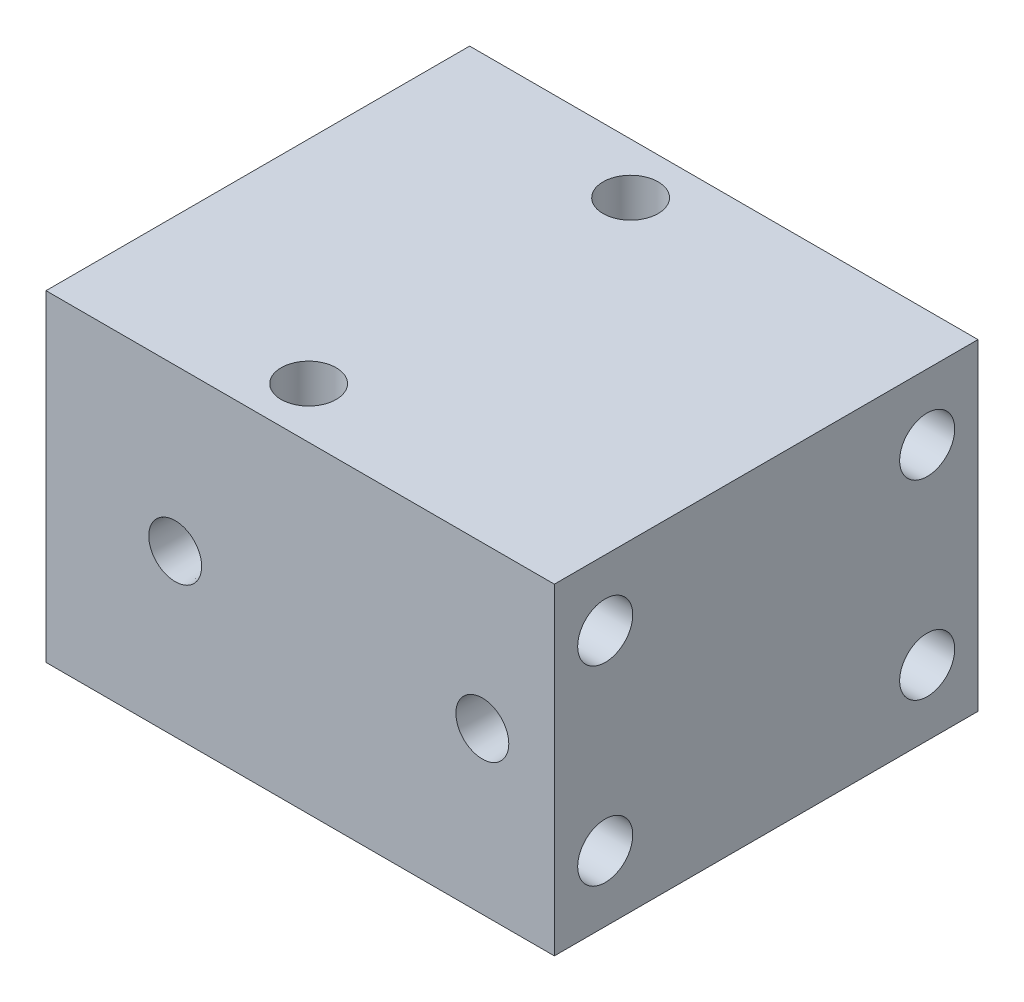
SolidWorks part; units mm, degrees
ref_plane "Front Plane" through (0, 0, 0) normal (0, 0, 1) x (1, 0, 0)
ref_plane "Top Plane" through (0, 0, 0) normal (0, 1, 0) x (1, 0, 0)
ref_plane "Right Plane" through (0, 0, 0) normal (1, 0, 0) x (0, 0, -1)
sketch "Sketch1" plane through (0, 0, 0) normal (0, 1, 0) x (1, 0, 0)
  line L0 (-10, 38) -> (-10, -38) construction
  line L1 (-60, 50) -> (60, 50)
  line L2 (-60, 50) -> (-60, -50)
  line L3 (-60, -50) -> (60, -50)
  line L4 (60, 50) -> (60, -50)
  line L5 (-60, 0) -> (-10, 0) construction
  circle A0 centre (-10, 38) radius 6.5
  circle A1 centre (-10, -38) radius 6.5
  dimension "D5" = 13
  dimension "D6" = 13
  dimension "D8" = 50
  dimension "D1" = 100
  dimension "D2" = 50
  dimension "D3" = 120
  dimension "D4" = 60
  dimension "D7" = 76
extrude "H1" add sketch "Sketch1" along normal blind 76
sketch "Sketch2" plane through (-60, 0, 0) normal (-1, 0, 0) x (0, 0, 1)
  line L0 (0, 0) -> (0, 38) construction
  line L1 (50, 38) -> (0, 38) construction
  line L2 (50, 76) -> (50, 0) construction
  circle A0 centre (0, 38) radius 0.5
  dimension "D1" = 1
extrude "CENTER HOLE" cut sketch "Sketch2" against normal blind 60
hole_wizard "1/4 NPT Tapped Hole1" positions "Sketch4" profile "Sketch3" size "1/4" standard "Ansi Inch"
sketch "Sketch4" plane through (0, 0, 50) normal (0, 0, 1) x (1, 0, 0)
  line L0 (-60, 38) -> (60, 38) construction
  line L1 (-60, 76) -> (-60, 0) construction
  line L2 (60, 76) -> (60, 0) construction
  point P0 (43, 38)
  point P1 (-29.5, 38)
  dimension "D1" = 30.5
  dimension "D2" = 17
sketch "Sketch3" plane through (43, 38, 50) normal (1, 0, 0) x (0, -1, 0)
  line L0 (0, 0) -> (0, 20.4123)
  line L1 (5.5626, 17.07) -> (0, 20.4123)
  line L2 (-5.5626, 17.07) -> (0, 20.4123) construction
  line L3 (5.5626, 17.07) -> (5.5626, 10.02)
  line L4 (5.5626, 10.02) -> (5.9437, 10.02)
  line L5 (5.9437, 10.02) -> (6.2437, 0)
  line L6 (-5.9437, 10.02) -> (-6.2437, 0) construction
  line L7 (6.2437, 0) -> (0, 0)
  line L8 (0, -6.35) -> (0, 107.95) construction
  line L11 (-5.5626, 10.02) -> (-5.9437, 10.02) construction
  dimension "Tap Drill Dia." = 11.1252
  dimension "Tap Drill Depth" = 17.07
  dimension "Thread Dia." = 12.4874
  dimension "Thread Angle" = 3.43
  dimension "Thread Depth" = 10.02
  dimension "Drill Angle" = 118
sketch "Sketch6" plane through (-60, 0, 0) normal (-1, 0, 0) x (0, 0, 1)
  line L0 (-38, 76) -> (-38, 0) construction
  line L1 (38, 76) -> (38, 0) construction
  line L3 (-38, 60.5) -> (38, 60.5) construction
  line L5 (-38, 15.5) -> (38, 15.5) construction
  circle A0 centre (-38, 60.5) radius 6.5
  circle A1 centre (-38, 15.5) radius 6.5
  circle A2 centre (38, 60.5) radius 6.5
  circle A3 centre (38, 15.5) radius 6.5
  dimension "D3" = 13
  dimension "D1" = 22.5
  dimension "D2" = 45
extrude "MTG HOLE" cut sketch "Sketch6" against normal up to surface (120 mm away)
sketch "Sketch5" plane through (0, 0, 50) normal (0, 0, 1) x (1, 0, 0)
  circle A0 centre (-29.5, 38) radius 2
  circle A1 centre (43, 38) radius 2
  circle A2 centre (43, 38) radius 6.2437 construction
  circle A3 centre (-29.5, 38) radius 6.2437 construction
  dimension "D1" = 4
  dimension "D2" = 4
extrude "OIL HOLE" cut sketch "Sketch5" against normal blind 20
equation "\"D1@Sketch6\"=\"D2@Sketch6\"/2"
equation "\"D5@Sketch1\" = \"D6@Sketch1\""
equation "\"D2@Sketch1\" = \"D1@Sketch1\"/2"
equation "\"D4@Sketch1\"=\"D3@Sketch1\" / 2"
